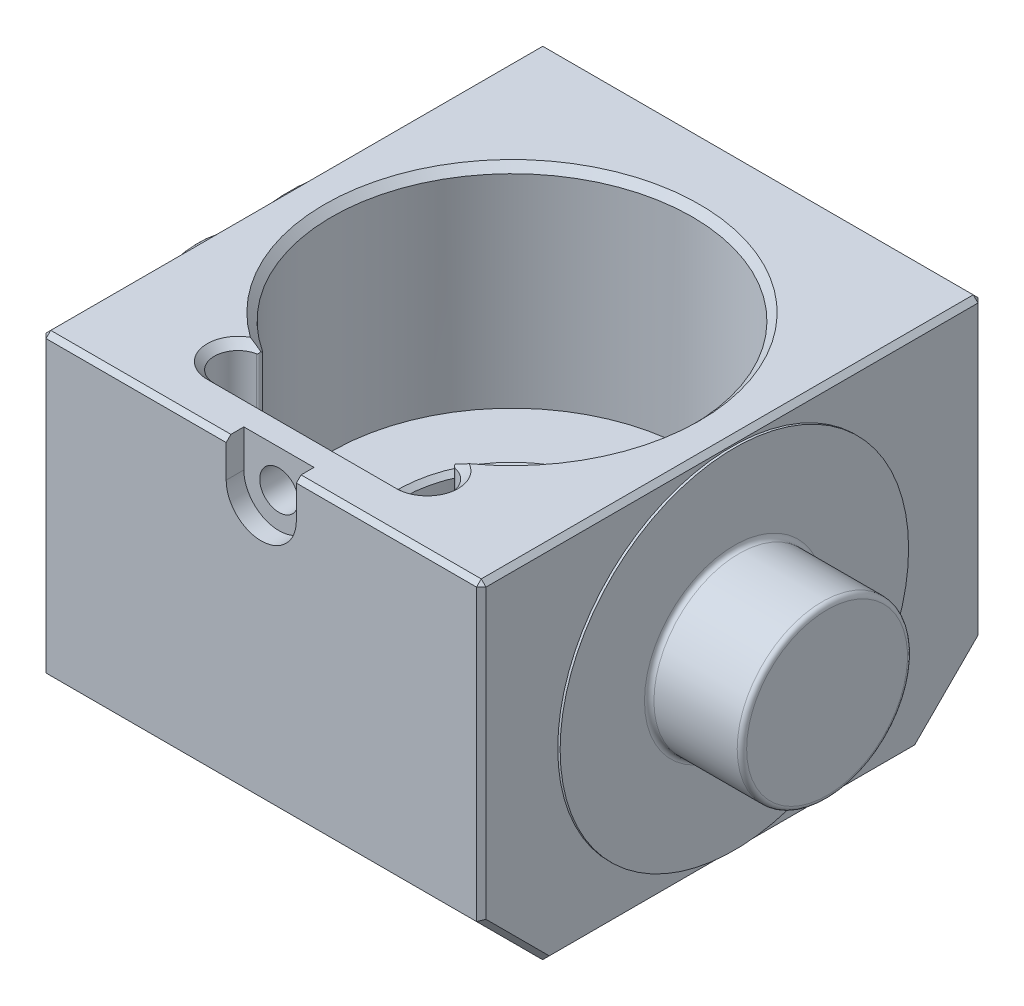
SolidWorks part; units mm, degrees
ref_plane "Front Plane" through (0, 0, 0) normal (0, 0, 1) x (1, 0, 0)
ref_plane "Top Plane" through (0, 0, 0) normal (0, 1, 0) x (1, 0, 0)
ref_plane "Right Plane" through (0, 0, 0) normal (1, 0, 0) x (0, 0, -1)
sketch "Sketch1" plane through (0, 0, 0) normal (1, 0, 0) x (0, 0, -1)
  line L1 (-26.5, 19.05) -> (26.5, 19.05)
  line L2 (-26.5, 19.05) -> (-26.5, -19.05)
  line L3 (-26.5, -19.05) -> (26.5, -19.05)
  line L4 (26.5, 19.05) -> (26.5, -19.05)
  line L5 (-26.5, 19.05) -> (26.5, -19.05) construction
  line L6 (-26.5, -19.05) -> (26.5, 19.05) construction
  point P0 (0, 0)
  dimension "D1" = 38.1
  dimension "D2" = 53
extrude "Boss-Extrude1" add sketch "Sketch1" along normal mid plane 46.5
sketch "Sketch2" plane through (0, 0, 0) normal (0, 0, 1) x (1, 0, 0)
  line L0 (0, 0) -> (15.0375, 0) construction
  line L1 (23.25, 18.415) -> (23.5, 18.415)
  line L2 (23.25, 19.05) -> (23.25, -19.05) construction
  line L3 (23.5, 18.415) -> (23.5, 9)
  line L4 (23.5, 9) -> (33.3, 9)
  line L5 (33.3, 9) -> (33.3, 0)
  line L6 (33.3, 0) -> (23.25, 0)
  line L7 (23.25, 0) -> (23.25, 18.415)
  line L8 (0, 10.193) -> (0, -1.9896) construction
  dimension "D1" = 36.83
  dimension "D2" = 47
  dimension "D3" = 18
  dimension "D4" = 66.6
revolve "Revolve1" add sketch "Sketch2" angle 360 about L0
mirror "Mirror1" about plane through (0, 0, 0) normal (1, 0, 0) of "Revolve1"
sketch "Sketch3" plane through (0, 0, 0) normal (0, 0, 1) x (1, 0, 0)
  line L0 (0, 19.05) -> (0, -3.175)
  line L1 (23.25, 19.05) -> (-23.25, 19.05) construction
  line L2 (0, -3.175) -> (-19.0538, -3.175)
  line L3 (-19.0538, -3.175) -> (-19.0538, 19.05)
  line L4 (-19.0538, 19.05) -> (0, 19.05)
  line L5 (0, 10.1247) -> (0, -4.0859) construction
  dimension "D1" = 38.1076
  dimension "D2" = 3.175
revolve "Cut-Revolve1" cut sketch "Sketch3" angle 360 about L5
sketch "Sketch4" plane through (0, 0, 0) normal (0, 0, 1) x (1, 0, 0)
  line L0 (0, -19.05) -> (0, -3.175)
  line L1 (23.25, -19.05) -> (-23.25, -19.05) construction
  line L2 (0, -19.05) -> (-11.557, -19.05)
  line L3 (-11.557, -19.05) -> (-11.557, -3.175)
  line L4 (19.0538, -3.175) -> (-19.0538, -3.175) construction
  line L5 (-11.557, -3.175) -> (0, -3.175)
  line L6 (0, -1.9252) -> (0, -23.8317) construction
  dimension "D1" = 23.114
revolve "Cut-Revolve2" cut sketch "Sketch4" angle 360 about L6
sketch "Sketch5" plane through (0, 19.05, 0) normal (0, 1, 0) x (1, 0, 0)
  line L0 (-10, -18.9554) -> (10, -18.9554) construction
  line L1 (-10, -16.4554) -> (10, -16.4554)
  line L2 (-10, -21.4554) -> (10, -21.4554)
  line L3 (-1.1729, 0) -> (1.6976, 0) construction
  arc A0 (-10, -16.4554) -> (-10, -21.4554) centre (-10, -18.9554) ccw
  arc A1 (10, -21.4554) -> (10, -16.4554) centre (10, -18.9554) ccw
  circle A4 centre (0, 0) radius 19.0538 construction
  point P2 (0, -18.9554)
  dimension "D1" = 35.5092
  dimension "D2" = 16.4554
  dimension "D3" = 5
  dimension "D4" = 20
extrude "Cut-Extrude1" cut sketch "Sketch5" against normal blind 6.5
chamfer "Chamfer1" distance 6.985 angle 45 2 edges at (0, -19.05, -26.5) (0, -19.05, 26.5)
chamfer "Chamfer2" distance 0.5 angle 45 14 edges at (23.25, -15.5575, 23.0075) (23.25, 3.4925, 26.5) (23.25, -19.05, 0) (23.25, -15.5575, -23.0075) (23.25, 3.4925, -26.5) (-23.25, 3.4925, 26.5) (-23.25, -15.5575, 23.0075) (-23.25, -19.05, 0) (-23.25, -15.5575, -23.0075) (-23.25, 3.4925, -26.5) (0, 19.05, -26.5) (23.25, 19.05, 0) (0, 19.05, 26.5) (-23.25, 19.05, 0)
chamfer "Chamfer4" distance 0.762 angle 45 6 edges at (-9.8028, 19.05, 16.4554) (-12.5, 19.05, 18.9554) (0, 19.05, 21.4554) (12.5, 19.05, 18.9554) (9.8028, 19.05, 16.4554) (0, 19.05, -19.0538)
fillet "Fillet1" radius 0.3 2 edges at (9.6056, 15.419, 16.4554) (-9.6056, 15.419, 16.4554)
chamfer "Chamfer5" distance 0.5 angle 45 2 edges at (0, -3.175, 11.557) (0, -19.05, 11.557)
fillet "Fillet2" radius 0.5 2 edges at (-33.3, 0, 9) (33.3, 0, 9)
fillet "Fillet3" radius 0.5 2 edges at (23.5, 0, 9) (-23.5, 0, 9)
sketch "Sketch9" plane through (0, 0, 26.5) normal (0, 0, 1) x (1, 0, 0)
  line L0 (0, 12.55) -> (0, 19.05) construction
  line L1 (-10, 12.55) -> (10, 12.55) construction
  line L2 (-22.75, 19.05) -> (22.75, 19.05) construction
  circle A0 centre (0, 15.11) radius 2.032
  circle A1 centre (0, 15.11) radius 3.3274 construction
  dimension "D1" = 4.064
  dimension "D2" = 6.6548
  dimension "D3" = 3.94
extrude "Cut-Extrude2" cut sketch "Sketch9" against normal up to next
sketch "Sketch10" plane through (0, 0, 26.5) normal (0, 0, 1) x (1, 0, 0)
  line L0 (0, 22.99) -> (0, 15.11) construction
  line L1 (-22.75, 19.05) -> (22.75, 19.05) construction
  line L2 (3.7084, 22.99) -> (3.7084, 15.11)
  line L3 (-3.7084, 22.99) -> (-3.7084, 15.11)
  arc A0 (3.7084, 22.99) -> (-3.7084, 22.99) centre (0, 22.99) ccw
  arc A1 (-3.7084, 15.11) -> (3.7084, 15.11) centre (0, 15.11) ccw
  point P5 (0, 19.05)
  dimension "D1" = 3.7084
extrude "Cut-Extrude3" cut sketch "Sketch10" against normal offset from surface (1.8696 mm away) 3.175
